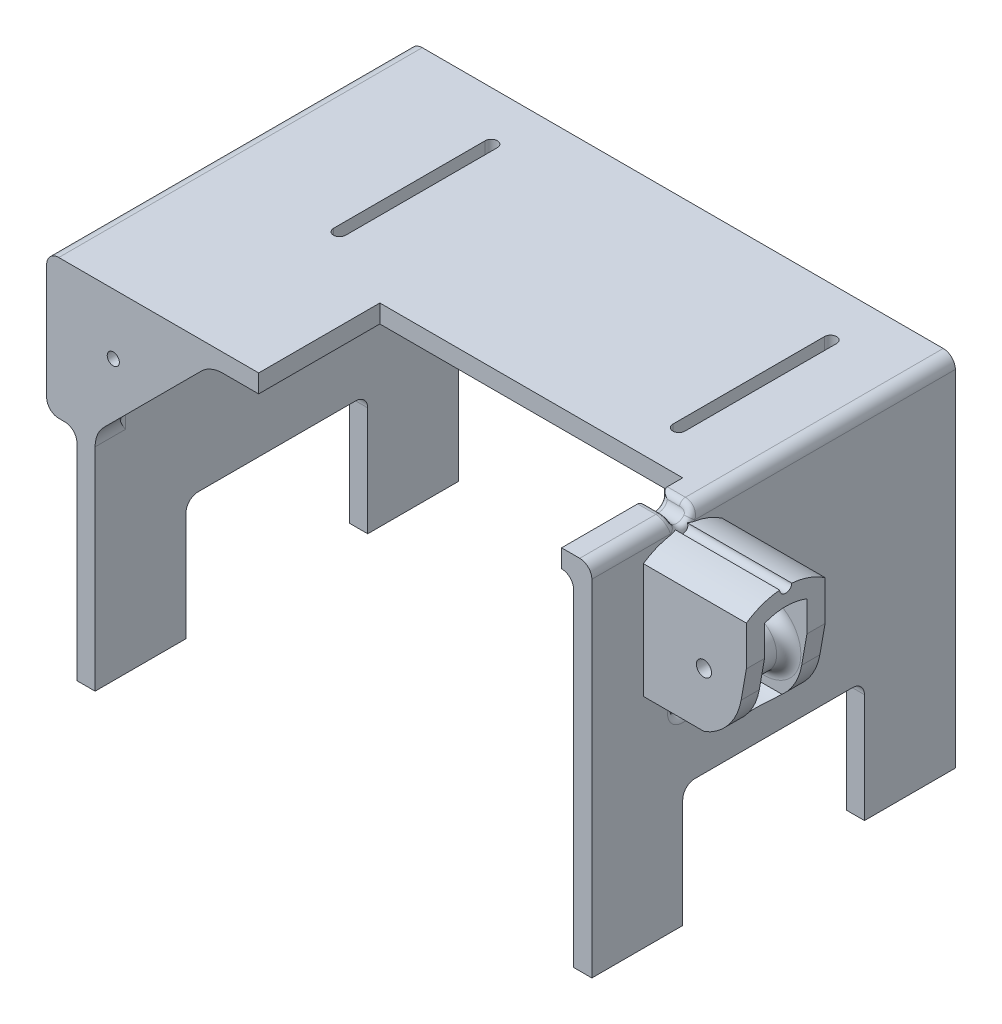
SolidWorks part; units mm, degrees
ref_plane "Plan de face" through (0, 0, 0) normal (0, 0, 1) x (1, 0, 0)
ref_plane "Plan de dessus" through (0, 0, 0) normal (0, 1, 0) x (1, 0, 0)
ref_plane "Plan de droite" through (0, 0, 0) normal (1, 0, 0) x (0, 0, -1)
sketch "Esquisse1" plane through (0, 0, 0) normal (0, 0, 1) x (1, 0, 0)
  line L0 (-3, 115) -> (-87, 115)
  line L1 (0, 0) -> (-90, 0)
  line L2 (0, 0) -> (0, 118)
  line L3 (0, 118) -> (-90, 118)
  line L4 (-90, 0) -> (-90, 20)
  line L5 (-87, 3) -> (-87, 20)
  line L6 (-3, 3) -> (-87, 3)
  line L7 (-3, 3) -> (-3, 115)
  line L8 (-90, 98) -> (-87, 98)
  line L9 (-90, 20) -> (-87, 20)
  line L10 (-87, 98) -> (-87, 115)
  line L11 (-90, 98) -> (-90, 118)
  line L12 (-87, 3) -> (-87, 115) construction
  line L14 (-90, 0) -> (-90, 118) construction
  dimension "D1" = 90
  dimension "D2" = 118
  dimension "D4" = 20
  dimension "D5" = 20
  dimension "D3" = 3
extrude "Boss.-Extru.2" add sketch "Esquisse1" along normal blind 60 contours L3 L11 L8 L10 L0 L7 L6 L5 L9 L4 L1 L2
ref_plane "Plan1" through (0, 0, 45) normal (0, 0, 1) x (1, 0, 0)
sketch "Esquisse2" plane through (0, 0, 0) normal (1, 0, 0) x (0, 0, -1)
  line L0 (-48.5, 112.246) -> (-48.5, 96.754)
  line L1 (-45, 84.9462) -> (-45, 52.4993) construction
  line L2 (-51.5, 113.9868) -> (-51.5, 95.0132)
  line L3 (-60, 0) -> (-60, 118) construction
  line L4 (-38.5, 113.9868) -> (-38.5, 95.0132)
  line L5 (-60, 118) -> (0, 118) construction
  line L6 (-76.0782, 45) -> (5.983, 45) construction
  line L7 (-41.5, 112.246) -> (-41.5, 96.754)
  line L10 (-81.25, 104.5) -> (-8.75, 104.5) construction
  arc A0 (-41.5, 96.754) -> (-48.5, 96.754) centre (-45, 104.5) cw
  arc A1 (-38.5, 113.9868) -> (-44.0009, 115.9565) centre (-45, 104.5) ccw
  arc A2 (-41.5, 112.246) -> (-48.5, 112.246) centre (-45, 104.5) ccw
  arc A3 (-45.9991, 115.9565) -> (-44.0009, 115.9565) centre (-45, 116) ccw
  arc A4 (-45.9991, 115.9565) -> (-51.5, 113.9868) centre (-45, 104.5) ccw
  arc A6 (-38.5, 113.9868) -> (-51.5, 113.9868) centre (-45, 104.5) ccw construction
  arc A7 (-38.5, 95.0132) -> (-51.5, 95.0132) centre (-45, 104.5) cw
  point P14 (-48.75, 57.5)
  point P16 (-61.25, 57.5)
extrude "Boss.-Extru.4" add sketch "Esquisse2" along normal blind 18.5
sketch "Esquisse5" plane through (0, 0, 45) normal (0, 0, 1) x (1, 0, 0)
  line L1 (0, 0) -> (0, 118) construction
  circle A0 centre (10, 104) radius 1.25
  point P6 (0, 59)
  dimension "D1" = 2.5
  dimension "D3" = 10
extrude "Enlèv. mat.-Extru.2" cut sketch "Esquisse5" against normal through all and the other way through all
sketch "Esquisse8" plane through (0, 0, 45) normal (0, 0, 1) x (1, 0, 0)
  circle A0 centre (10, 104) radius 4
  dimension "D1" = 8
extrude "Boss.-Extru.6" add sketch "Esquisse8" along normal up to surface and the other way up to surface
fillet "Congé3" radius 2 2 edges at (6, 104, 48.5) (14, 104, 41.5)
ref_plane "Plan2" through (0, 59, 0) normal (0, -1, 0) x (-1, 0, 0)
sketch "Esquisse9" plane through (0, 0, 60) normal (0, 0, 1) x (1, 0, 0)
  line L0 (-87, 98) -> (-82, 98)
  line L1 (-82, 98) -> (-82, 20)
  line L2 (-82, 20) -> (-87, 20)
  line L3 (-90, 20) -> (-90, 23)
  line L4 (-90, 23) -> (-85, 23)
  line L5 (-85, 23) -> (-85, 95)
  line L6 (-85, 95) -> (-90, 95)
  line L7 (-90, 95) -> (-90, 98)
  line L8 (-90, 98) -> (-87, 98)
  line L9 (-87, 20) -> (-90, 20)
  line L10 (-87, 98) -> (-87, 115) construction
  dimension "D1" = 3
  dimension "D2" = 3
  dimension "D3" = 3
  dimension "D4" = 5
extrude "Boss.-Extru.7" add sketch "Esquisse9" against normal up to surface (60 mm away)
sketch "Esquisse10" plane through (0, 0, 0) normal (0, -1, 0) x (1, 0, 0)
  line L0 (-82, 0) -> (-82, 60) construction
  line L1 (-82, 50) -> (-62, 50)
  line L2 (-82, 50) -> (-82, 10)
  line L3 (-82, 10) -> (-62, 10)
  line L4 (-62, 50) -> (-62, 10)
  line L5 (-90, 60) -> (-90, 0) construction
  point P8 (-90, 30)
extrude "Enlèv. mat.-Extru.3" cut sketch "Esquisse10" against normal up to next
sketch "Esquisse11" plane through (0, 118, 0) normal (0, 1, 0) x (1, 0, 0)
  line L0 (0, -60) -> (-90, -60) construction
  line L1 (-5, -60) -> (-55, -60)
  line L2 (-5, -60) -> (-5, -40)
  line L3 (-5, -40) -> (-55, -40)
  line L4 (-55, -60) -> (-55, -40)
  line L5 (0, -60) -> (0, 0) construction
  dimension "D1" = 20
  dimension "D2" = 50
  dimension "D3" = 5
extrude "Enlèv. mat.-Extru.4" cut sketch "Esquisse11" against normal up to next
sketch "Esquisse12" plane through (0, 0, 0) normal (1, 0, 0) x (0, 0, -1)
  line L2 (-30, 118) -> (-30, 0) construction
  line L3 (-60, 118) -> (0, 118) construction
  line L4 (-60, 0) -> (0, 0) construction
  line L6 (-45, 39) -> (-15, 39)
  line L7 (-45, 39) -> (-45, 79)
  line L8 (-45, 79) -> (-15, 79)
  line L9 (-15, 39) -> (-15, 79)
  line L10 (-45, 39) -> (-15, 79) construction
  line L11 (-45, 79) -> (-15, 39) construction
  point P0 (-30, 59)
  dimension "D1" = 40
  dimension "D2" = 30
extrude "Enlèv. mat.-Extru.5" cut sketch "Esquisse12" against normal through all
sketch "Esquisse13" plane through (0, 0, 0) normal (1, 0, 0) x (0, 0, -1)
  line L0 (-46.5, 104) -> (-43.5, 104) construction
  line L1 (-64.8515, 104) -> (-44.7368, 104) construction
  line L2 (-48.5, 104) -> (-51.5, 104) construction
  line L3 (-45, 121.2099) -> (-45, 85.4835) construction
  line L4 (-45, 38.5) -> (-45, -38.5) construction
  circle A0 centre (-45, 90.5) radius 1.5
  circle A1 centre (-45, 117.5) radius 1.5
  dimension "D1" = 3
  dimension "D2" = 13.5
extrude "Enlèv. mat.-Extru.6" cut sketch "Esquisse13" against normal up to next and the other way through all
fillet "Congé4" radius 2 29 edges at (-3, 3, 30) (-87, 3, 30) (-87, 20, 30) (-85, 23, 30) (-85, 95, 30) (-87, 98, 30) (-87, 115, 30) (-3, 115, 30) (0, 0, 30) (-90, 0, 30) (-82, 20, 30) (-90, 23, 30) (-90, 95, 30) (-90, 118, 30) (0, 118, 21.7929) (0, 118, 53.2071) (-82, 98, 30) (-62, 1.5, 50) (-82, 1.5, 50) (-62, 1.5, 10) (-82, 1.5, 10) (-83.5, 39, 15) (-83.5, 39, 45) (-83.5, 79, 45) (-83.5, 79, 15) (-1.5, 79, 15) (-1.5, 79, 45) (-1.5, 39, 45) (-1.5, 39, 15)
sketch "Esquisse14" plane through (0, 0, 0) normal (0, 0, -1) x (-1, 0, 0)
  line L0 (85, 93) -> (-3.2573, 93) construction
  line L2 (85, 93) -> (60, 118)
  line L3 (-18.5, 93) -> (0, 93) construction
  line L4 (0, 93) -> (25, 118)
  line L5 (0, 59) -> (87, 59) construction
  line L6 (-49.5094, 59) -> (49.5094, 59) construction
  line L7 (85, 25) -> (60, 0)
  line L8 (0, 116) -> (0, 2)
  line L9 (2, 0) -> (88, 0)
  line L10 (90, 2) -> (90, 21)
  line L11 (88, 23) -> (87, 23)
  line L12 (85, 25) -> (85, 93)
  line L13 (87, 95) -> (88, 95)
  line L14 (90, 97) -> (90, 116)
  line L15 (88, 118) -> (2, 118)
  line L16 (0, 116) -> (0, 93)
  line L17 (2, 0) -> (25, 0)
  line L18 (90, 2) -> (90, 21)
  line L19 (88, 23) -> (87, 23)
  line L21 (87, 95) -> (88, 95)
  line L22 (90, 97) -> (90, 116)
  line L23 (88, 118) -> (60, 118)
  line L24 (0, 25) -> (25, 0)
  line L25 (25, 118) -> (2, 118)
  line L26 (0, 25) -> (0, 2)
  line L27 (60, 0) -> (88, 0)
  circle A0 centre (79, 108) radius 1
  circle A1 centre (8, 108) radius 1
  circle A2 centre (79, 10) radius 1
  circle A3 centre (8, 10) radius 1
  arc A8 (0, 2) -> (2, 0) centre (2, 2) ccw
  arc A9 (88, 0) -> (90, 2) centre (88, 2) ccw
  arc A10 (90, 21) -> (88, 23) centre (88, 21) ccw
  arc A11 (85, 25) -> (87, 23) centre (87, 25) ccw
  arc A12 (87, 95) -> (85, 93) centre (87, 93) ccw
  arc A13 (88, 95) -> (90, 97) centre (88, 97) ccw
  arc A14 (90, 116) -> (88, 118) centre (88, 116) ccw
  arc A15 (2, 118) -> (0, 116) centre (2, 116) ccw
  arc A16 (0, 2) -> (2, 0) centre (2, 2) ccw
  arc A17 (88, 0) -> (90, 2) centre (88, 2) ccw
  arc A18 (90, 21) -> (88, 23) centre (88, 21) ccw
  arc A19 (85, 25) -> (87, 23) centre (87, 25) ccw
  arc A20 (87, 95) -> (85, 93) centre (87, 93) ccw
  arc A21 (88, 95) -> (90, 97) centre (88, 97) ccw
  arc A22 (90, 116) -> (88, 118) centre (88, 116) ccw
  arc A23 (2, 118) -> (0, 116) centre (2, 116) ccw
  dimension "D4" = 2
  dimension "D6" = 10
  dimension "D7" = 2
  dimension "D8" = 8
  dimension "D9" = 10
  dimension "D2" = 45
  dimension "D3" = 45
  dimension "D5" = 11
  dimension "D1" = 0
extrude "Boss.-Extru.8" add sketch "Esquisse14" against normal blind 3
pattern_linear "Répétition linéaire1" count 2 spacing 57 along (0, 0, 1) of "Boss.-Extru.8"
sketch "Esquisse15" plane through (0, 0, 57) normal (0, 0, -1) x (-1, 0, 0)
  line L4 (5, 118) -> (5, 115)
  line L5 (3, 113) -> (3, 96)
  line L6 (3, 96) -> (25, 118)
  line L7 (25, 118) -> (5, 118)
  line L8 (5, 118) -> (5, 115)
  line L9 (3, 113) -> (3, 96)
  line L10 (3, 96) -> (25, 118)
  line L11 (25, 118) -> (5, 118)
  arc A1 (5, 115) -> (3, 113) centre (5, 113) ccw
  arc A2 (5, 115) -> (3, 113) centre (5, 113) ccw
  dimension "D1" = 0
extrude "Enlèv. mat.-Extru.7" cut sketch "Esquisse15" against normal through all
sketch "Esquisse16" plane through (0, 0, 45) normal (0, 0, 1) x (1, 0, 0)
  line L0 (18.5, 115.95) -> (16.133, 102.526)
  line L1 (8.0214, 94.4144) -> (0, 93)
  line L2 (18.5, 113.9868) -> (18.5, 95.0132) construction
  line L3 (0, 93) -> (18.5, 93) construction
  line L4 (18.5, 115.95) -> (18.5, 93)
  line L5 (18.5, 93) -> (0, 93)
  arc A0 (16.133, 102.526) -> (8.0214, 94.4144) centre (6.2849, 104.2625) cw
  dimension "D1" = 10
  dimension "D2" = 10
  dimension "D3" = 10
extrude "Enlèv. mat.-Extru.8" cut sketch "Esquisse16" against normal through all both and the other way through all
sketch "Esquisse17" plane through (0, 0, 0) normal (1, 0, 0) x (0, 0, -1)
  line L4 (-41.5, 96.754) -> (-41.5, 112.246)
  line L5 (-41.5, 96.754) -> (-41.5, 112.246)
  line L6 (-48.5, 112.246) -> (-48.5, 96.754)
  line L7 (-48.5, 112.246) -> (-48.5, 96.754)
  arc A4 (-41.5, 112.246) -> (-48.5, 112.246) centre (-45, 104.5) ccw
  arc A5 (-41.5, 112.246) -> (-48.5, 112.246) centre (-45, 104.5) ccw
  arc A6 (-48.5, 96.754) -> (-41.5, 96.754) centre (-45, 104.5) ccw
  arc A7 (-48.5, 96.754) -> (-41.5, 96.754) centre (-45, 104.5) ccw
  dimension "D1" = 0
extrude "Enlèv. mat.-Extru.9" cut sketch "Esquisse17" against normal up to next
mirror "Symétrie3" about plane through (0, 59, 0) normal (0, -1, 0) of "Enlèv. mat.-Extru.8", "Enlèv. mat.-Extru.9", "Congé3", "Enlèv. mat.-Extru.2", "Boss.-Extru.4", "Boss.-Extru.6"
fillet "Congé5" radius 5 14 edges at (-82, 96, 58.5) (-63, 115, 58.5) (-82, 96, 1.5) (-63, 115, 1.5) (-22, 115, 1.5) (-3, 96, 1.5) (-63, 3, 58.5) (-82, 22, 58.5) (-82, 22, 1.5) (-63, 3, 1.5) (-22, 3, 1.5) (-22, 3, 58.5) (-3, 22, 58.5) (-3, 22, 1.5)
fillet "Congé6" radius 2 50 edges at (-3.5858, 114.4142, 3) (-14.5355, 115, 3) (-3, 103.4645, 3) (-3.5858, 3.5858, 3) (-3, 14.5355, 3) (-14.5355, 3, 3) (-86.4142, 3.5858, 3) (-72.9645, 3, 3) (-86.4142, 19.4142, 3) (-87, 11.5, 3) (-84.5, 20, 3) (-82.5858, 20.5858, 3) (-86.4142, 114.4142, 3) (-82.5858, 97.4142, 3) (-84.5, 98, 3) (-72.9645, 115, 3) (-87, 106.5, 3) (-86.4142, 98.5858, 3) (-86.4142, 19.4142, 57) (-87, 11.5, 57) (-86.4142, 3.5858, 57) (-72.9645, 3, 57) (-84.5, 20, 57) (-82.5858, 20.5858, 57) (-86.4142, 114.4142, 57) (-87, 106.5, 57) (-86.4142, 98.5858, 57) (-82.5858, 97.4142, 57) (-84.5, 98, 57) (-72.9645, 115, 57) (17.9798, 113, 45) (-3, 96, 45) (17.9798, 5, 45) (-3, 22, 45) (-82, 23.0355, 3) (-82, 23.0355, 57) (-82, 94.9645, 3) (-82, 94.9645, 57) (-81.6194, 95.8423, 57) (-62.8423, 114.6194, 57) (-81.6194, 95.8423, 3) (-62.8423, 114.6194, 3) (-22.1577, 114.6194, 3) (-3.3806, 95.8423, 3) (-62.8423, 3.3806, 57) (-81.6194, 22.1577, 57) (-81.6194, 22.1577, 3) (-62.8423, 3.3806, 3) (-22.1577, 3.3806, 3) (-3.3806, 22.1577, 3)
sketch "Esquisse18" plane through (0, 115, 0) normal (0, -1, 0) x (1, 0, 0)
  line L0 (-5, 3) -> (-20, 3) construction
  line L1 (-5, 40) -> (-55, 40) construction
  line L2 (-8, 40) -> (-3, 40)
  line L3 (-8, 40) -> (-8, 3)
  line L4 (-8, 3) -> (-3, 3)
  line L5 (-3, 40) -> (-3, 3)
  line L7 (-3, 45) -> (-3, 5) construction
  dimension "D1" = 5
  dimension "D2" = 5
extrude "Boss.-Extru.9" add sketch "Esquisse18" along normal blind 2
fillet "Congé7" radius 2 3 edges at (-6.5, 113, 3) (-3.5858, 113, 3.5858) (-3, 113, 22.5)
sketch "Esquisse19" plane through (0, 118, 0) normal (0, 1, 0) x (1, 0, 0)
  line L0 (-68.5, -38.5217) -> (-68.5, -3.2296) construction
  line L1 (-12.5, -38.5217) -> (-12.5, -3) construction
  line L2 (-12.5, -33.1377) -> (-12.5, -8.106) construction
  line L3 (-13.5, -33.1377) -> (-13.5, -8.106)
  line L4 (-11.5, -33.1377) -> (-11.5, -8.106)
  line L5 (-68.5, -33.1377) -> (-68.5, -8.106) construction
  line L9 (-69.5, -33.1377) -> (-69.5, -8.106)
  line L10 (-8, -3) -> (-20, -3) construction
  line L12 (-67.5, -33.1377) -> (-67.5, -8.106)
  arc A0 (-13.5, -33.1377) -> (-11.5, -33.1377) centre (-12.5, -33.1377) ccw
  arc A1 (-11.5, -8.106) -> (-13.5, -8.106) centre (-12.5, -8.106) ccw
  arc A2 (-69.5, -33.1377) -> (-67.5, -33.1377) centre (-68.5, -33.1377) ccw
  arc A3 (-67.5, -8.106) -> (-69.5, -8.106) centre (-68.5, -8.106) ccw
  point P8 (-12.5, -20.6219)
  point P17 (-68.5, -20.6219)
  dimension "D1" = 1
  dimension "D2" = 2
extrude "Enlèv. mat.-Extru.10" cut sketch "Esquisse19" against normal up to next
fillet "Congé8" radius 1 1 edges at (18.3325, 115, 45)
fillet "Congé9" radius 1 7 edges at (-3.5, 118, 46.4142) (-0.1314, 116.7129, 46.2769) (-3.5, 118, 43.5858) (-0.2989, 117.0518, 43.5685) (-5, 116, 45) (0, 90.5, 46.5) (-3, 90.5, 46.5)
sketch "Esquisse20" plane through (0, 0, 45) normal (0, 0, 1) x (1, 0, 0)
  line L1 (17, 118.6789) -> (31.4716, 118.6789)
  line L2 (17, 118.6789) -> (17, -11.9808)
  line L3 (17, -11.9808) -> (31.4716, -11.9808)
  line L4 (31.4716, 118.6789) -> (31.4716, -11.9808)
  dimension "D1" = 7
extrude "Enlèv. mat.-Extru.11" cut sketch "Esquisse20" against normal through all both and the other way through all
sketch "Esquisse21" plane through (0, 59, 0) normal (0, -1, 0) x (-1, 0, 0)
  line L1 (110.3054, 6.7079) -> (-30.224, 6.7079)
  line L2 (110.3054, 6.7079) -> (110.3054, -75.8861)
  line L3 (110.3054, -75.8861) -> (-30.224, -75.8861)
  line L4 (-30.224, 6.7079) -> (-30.224, -75.8861)
extrude "Enlèv. mat.-Extru.12" cut sketch "Esquisse21" along normal through all
equation "\"D4@Esquisse2\"=\"D2@Esquisse2\"/2"
equation "\"D2@Esquisse10\"=\"D1@Esquisse10\"/2"
